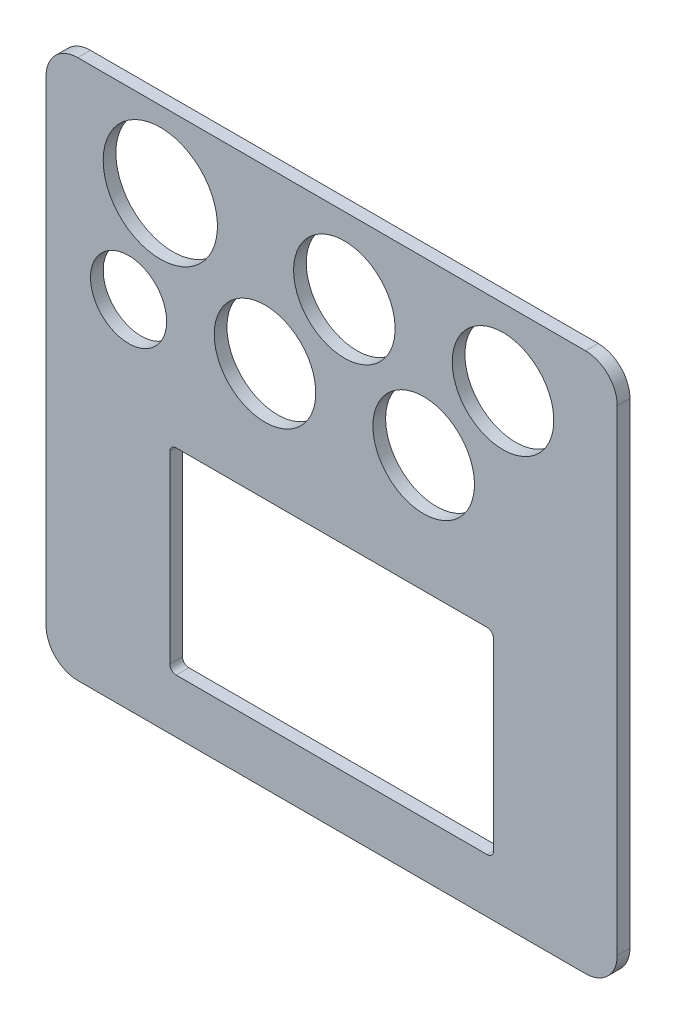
SolidWorks part; units mm, degrees
ref_plane "Спереди" through (0, 0, 0) normal (0, 0, 1) x (1, 0, 0)
ref_plane "Сверху" through (0, 0, 0) normal (0, 1, 0) x (1, 0, 0)
ref_plane "Справа" through (0, 0, 0) normal (1, 0, 0) x (0, 0, -1)
sketch "Эскиз1" plane through (0, 0, 0) normal (0, 0, 1) x (1, 0, 0)
  line L1 (-40, 42.5) -> (40, 42.5)
  line L2 (-45, 37.5) -> (-45, -37.5)
  line L3 (-40, -42.5) -> (40, -42.5)
  line L4 (45, 37.5) -> (45, -37.5)
  line L5 (-45, 42.5) -> (45, -42.5) construction
  line L6 (-45, -42.5) -> (45, 42.5) construction
  arc A0 (40, -42.5) -> (45, -37.5) centre (40, -37.5) ccw
  arc A1 (40, 42.5) -> (45, 37.5) centre (40, 37.5) cw
  arc A2 (-40, 42.5) -> (-45, 37.5) centre (-40, 37.5) ccw
  arc A3 (-45, -37.5) -> (-40, -42.5) centre (-40, -37.5) ccw
  point P0 (0, 0)
  dimension "D3" = 5
  dimension "D1" = 85
  dimension "D2" = 90
extrude "Бобышка-Вытянуть1" add sketch "Эскиз1" along normal blind 2
sketch "Эскиз5" plane through (0, 0, 0) normal (0, 0, -1) x (-1, 0, 0)
  line L5 (40, -42.5) -> (-40, -42.5) construction
  line L6 (-27.5, -36) -> (27.5, -36)
  line L11 (-27.5, -36) -> (-27.5, -39)
  line L12 (-27.5, -39) -> (27.5, -39)
  line L15 (27.5, -36) -> (27.5, -39)
  line L16 (-27.5, -36) -> (27.5, -39) construction
  line L17 (-27.5, -39) -> (27.5, -36) construction
  line L18 (-27.5, 2) -> (27.5, 2)
  line L19 (-27.5, 2) -> (-27.5, -1)
  line L20 (-27.5, -1) -> (27.5, -1)
  line L21 (27.5, 2) -> (27.5, -1)
  line L22 (-27.5, 2) -> (27.5, -1) construction
  line L23 (-27.5, -1) -> (27.5, 2) construction
  point P0 (0, -37.5)
  point P6 (0, 0.5)
  dimension "D1" = 3
  dimension "D2" = 55
  dimension "D3" = 35
  dimension "D4" = 5
extrude "Бобышка-Вытянуть2" add sketch "Эскиз5" along normal blind 0.01
sketch "Эскиз6" plane through (0, 0, 0) normal (0, 0, -1) x (-1, 0, 0)
  line L0 (27.5, -36) -> (-27.5, -36) construction
  line L1 (-25.5, -3) -> (25.5, -3)
  line L2 (-25.5, -3) -> (-25.5, -34)
  line L3 (-25.5, -34) -> (25.5, -34)
  line L4 (25.5, -3) -> (25.5, -34)
  line L5 (-25.5, -3) -> (25.5, -34) construction
  line L6 (-25.5, -34) -> (25.5, -3) construction
  point P0 (0, -18.5)
  dimension "D1" = 17.5
  dimension "D2" = 51
  dimension "D3" = 31
extrude "Вырез-Вытянуть3" cut sketch "Эскиз6" against normal through all
fillet "Скругление1" radius 1 4 edges at (25.5, -34, 1) (-25.5, -34, 1) (-25.5, -3, 1) (25.5, -3, 1)
sketch "Эскиз8" plane through (0, 0, 0) normal (0, 0, -1) x (-1, 0, 0)
  line L0 (-40, 42.5) -> (40, 42.5) construction
  line L1 (-45, -37.5) -> (-45, 37.5) construction
  line L2 (45, 37.5) -> (45, -37.5) construction
  circle A0 centre (-27, 30.5) radius 8
  circle A1 centre (-14.5, 15.5) radius 8
  circle A2 centre (-2, 30.5) radius 8
  circle A3 centre (10.5, 15.5) radius 8
  circle A4 centre (-27, 30.5) radius 8.5 construction
  circle A5 centre (-14.5, 15.5) radius 8.5 construction
  circle A6 centre (-2, 30.5) radius 8.5 construction
  circle A7 centre (10.5, 15.5) radius 8.5 construction
  circle A8 centre (27, 30.5) radius 9
  dimension "D1" = 16
  dimension "D2" = 17
  dimension "D9" = 18
  dimension "D3" = 12
  dimension "D4" = 18
  dimension "D5" = 25
  dimension "D6" = 12.5
  dimension "D7" = 15
  dimension "D8" = 25
  dimension "D10" = 18
extrude "Вырез-Вытянуть4" cut sketch "Эскиз8" against normal through all
sketch "Эскиз9" plane through (0, 0, 2) normal (0, 0, 1) x (1, 0, 0)
  circle A0 centre (-32, 13.5) radius 6
  dimension "D1" = 12
extrude "Вырез-Вытянуть5" cut sketch "Эскиз9" against normal up to surface (2 mm away)
